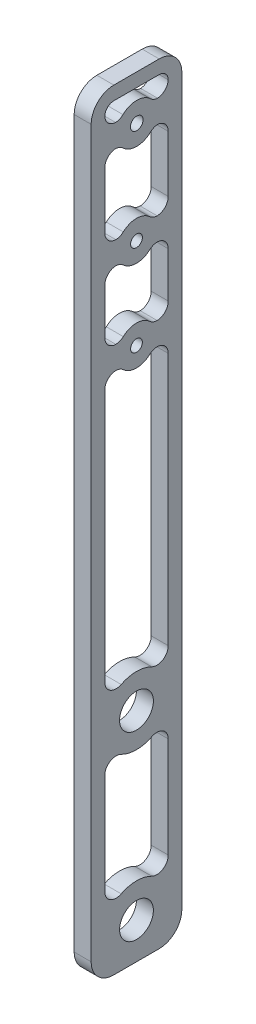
SolidWorks part; units mm, degrees
ref_plane "Front Plane" through (0, 0, 0) normal (0, 0, 1) x (1, 0, 0)
ref_plane "Top Plane" through (0, 0, 0) normal (0, 1, 0) x (1, 0, 0)
ref_plane "Right Plane" through (0, 0, 0) normal (1, 0, 0) x (0, 0, -1)
sketch "Sketch1" plane through (0, 0, 0) normal (1, 0, 0) x (0, 0, -1)
  line L5 (-12.7, -107.95) -> (12.7, -107.95)
  line L6 (-12.7, -107.95) -> (-12.7, 107.95)
  line L7 (-12.7, 107.95) -> (12.7, 107.95)
  line L8 (12.7, -107.95) -> (12.7, 107.95)
  line L9 (0, 107.95) -> (0, -107.95) construction
  line L10 (-12.7, 0) -> (12.7, 0) construction
  circle A0 centre (0, -97.79) radius 4.7371
  circle A1 centre (0, -46.99) radius 4.7371
  point P0 (0, 0)
  dimension "D3" = 50.8
  dimension "D4" = 9.4742
  dimension "D1" = 25.4
  dimension "D2" = 215.9
  dimension "D5" = 10.16
extrude "Boss-Extrude1" add sketch "Sketch1" along normal blind 4.7625
sketch "Sketch3" plane through (0, 0, 0) normal (-1, 0, 0) x (0, 0, 1)
  circle A0 centre (0, 41.5828) radius 1.651 construction
  circle A1 centre (0, 66.9828) radius 1.651 construction
  circle A2 centre (-0.0642, 95.4547) radius 1.778 construction
  circle A3 centre (0, 41.5828) radius 1.651
  circle A4 centre (0, 66.9828) radius 1.651
  circle A5 centre (-0.0642, 95.4547) radius 1.778
extrude "Cut-Extrude1" cut sketch "Sketch3" against normal through all
fillet "Fillet1" radius 6.35 4 edges at (2.3813, -107.95, 12.7) (2.3813, -107.95, -12.7) (2.3813, 107.95, -12.7) (2.3813, 107.95, 12.7)
sketch "Sketch4" plane through (4.7625, 0, 0) normal (1, 0, 0) x (0, 0, -1)
  line L16 (-12.7, 101.6) -> (-12.7, -101.6) construction
  line L17 (-6.35, -107.95) -> (6.35, -107.95) construction
  line L18 (12.7, -101.6) -> (12.7, 101.6) construction
  line L19 (6.35, 107.95) -> (-6.35, 107.95) construction
  line L20 (-12.7, 101.6) -> (-12.7, -101.6) construction
  line L21 (-6.35, -107.95) -> (6.35, -107.95) construction
  line L22 (12.7, -101.6) -> (12.7, 101.6) construction
  line L23 (6.35, 107.95) -> (-6.35, 107.95) construction
  line L24 (6.35, 104.14) -> (-6.35, 104.14)
  line L25 (-8.89, 101.6) -> (-8.89, 98.6297)
  line L26 (-6.35, -104.14) -> (-7.0654, -104.14) construction
  line L27 (8.89, -94.4418) -> (8.89, -50.3382)
  line L28 (-8.89, 98.6297) -> (-4.5342, 98.6297)
  line L29 (4.6626, 98.6297) -> (8.89, 98.6297)
  line L30 (8.89, 92.2797) -> (4.6626, 92.2797)
  line L31 (-4.5342, 92.2797) -> (-8.89, 92.2797)
  line L32 (-8.89, 98.6297) -> (-8.89, 92.2797) construction
  line L33 (-8.89, 92.2797) -> (-8.89, 70.1578)
  line L34 (-8.89, 101.6) -> (-8.89, -101.6) construction
  line L35 (8.89, 92.2797) -> (8.89, 98.6297) construction
  line L36 (8.89, 98.6297) -> (8.89, 101.6)
  line L37 (8.89, -101.6) -> (8.89, 101.6) construction
  line L38 (4.4432, 70.1578) -> (8.89, 70.1578)
  line L39 (8.89, 63.8078) -> (4.4432, 63.8078)
  line L40 (-8.89, 70.1578) -> (-4.4432, 70.1578)
  line L41 (-8.89, 63.8078) -> (-4.4432, 63.8078)
  line L42 (-8.89, 70.1578) -> (-8.89, 63.8078) construction
  line L43 (-8.89, 63.8078) -> (-8.89, 44.7578)
  line L44 (8.89, 63.8078) -> (8.89, 70.1578) construction
  line L45 (8.89, 70.1578) -> (8.89, 92.2797)
  line L46 (-8.89, -94.4418) -> (-8.89, -101.1382) construction
  line L47 (-8.89, -101.1382) -> (-8.89, -101.6) construction
  line L48 (-7.0654, -104.14) -> (7.0654, -104.14) construction
  line L49 (7.0654, -104.14) -> (6.35, -104.14) construction
  line L50 (-6.35, -104.14) -> (6.35, -104.14) construction
  line L51 (8.89, -101.6) -> (8.89, -101.1382) construction
  line L52 (8.89, -101.1382) -> (8.89, -94.4418) construction
  line L53 (8.89, 44.7578) -> (4.4432, 44.7578)
  line L54 (8.89, 38.4078) -> (4.4432, 38.4078)
  line L55 (-8.89, 44.7578) -> (-4.4432, 44.7578)
  line L56 (-8.89, 38.4078) -> (-4.4432, 38.4078)
  line L57 (8.89, 38.4078) -> (8.89, 44.7578) construction
  line L58 (8.89, 44.7578) -> (8.89, 63.8078)
  line L59 (-8.89, 44.7578) -> (-8.89, 38.4078) construction
  line L60 (-8.89, 38.4078) -> (-8.89, -43.6418)
  line L61 (8.89, -50.3382) -> (8.89, -43.6418) construction
  line L62 (8.89, -43.6418) -> (8.89, 38.4078)
  line L63 (-8.89, -43.6418) -> (-8.89, -50.3382) construction
  line L64 (-8.89, -50.3382) -> (-8.89, -94.4418)
  circle A0 centre (0, -97.79) radius 4.7371 construction
  circle A1 centre (0, -46.99) radius 4.7371 construction
  circle A2 centre (0, 41.5828) radius 1.651 construction
  circle A3 centre (0, 66.9828) radius 1.651 construction
  circle A4 centre (0.0642, 95.4547) radius 1.778 construction
  circle A5 centre (0, -97.79) radius 4.7371 construction
  circle A6 centre (0, -46.99) radius 4.7371 construction
  circle A7 centre (0, 41.5828) radius 1.651 construction
  circle A8 centre (0, 66.9828) radius 1.651 construction
  circle A9 centre (0.0642, 95.4547) radius 1.778 construction
  arc A10 (4.4432, 44.7578) -> (-4.4432, 44.7578) centre (0, 41.5828) ccw
  arc A11 (-4.4432, 63.8078) -> (4.4432, 63.8078) centre (0, 66.9828) ccw
  arc A12 (-4.5342, 92.2797) -> (-4.5342, 98.6297) centre (0.0642, 95.4547) ccw
  arc A13 (8.89, -94.4418) -> (-8.89, -94.4418) centre (0, -97.79) ccw
  arc A14 (8.89, -43.6418) -> (-8.89, -43.6418) centre (0, -46.99) ccw
  arc A15 (-6.35, 107.95) -> (-12.7, 101.6) centre (-6.35, 101.6) ccw construction
  arc A16 (-12.7, -101.6) -> (-6.35, -107.95) centre (-6.35, -101.6) ccw construction
  arc A17 (6.35, -107.95) -> (12.7, -101.6) centre (6.35, -101.6) ccw construction
  arc A18 (12.7, 101.6) -> (6.35, 107.95) centre (6.35, 101.6) ccw construction
  arc A19 (-6.35, 107.95) -> (-12.7, 101.6) centre (-6.35, 101.6) ccw construction
  arc A20 (-12.7, -101.6) -> (-6.35, -107.95) centre (-6.35, -101.6) ccw construction
  arc A21 (6.35, -107.95) -> (12.7, -101.6) centre (6.35, -101.6) ccw construction
  arc A22 (12.7, 101.6) -> (6.35, 107.95) centre (6.35, 101.6) ccw construction
  arc A23 (-6.35, 104.14) -> (-8.89, 101.6) centre (-6.35, 101.6) ccw
  arc A24 (-8.89, -101.6) -> (-6.35, -104.14) centre (-6.35, -101.6) ccw construction
  arc A25 (6.35, -104.14) -> (8.89, -101.6) centre (6.35, -101.6) ccw construction
  arc A26 (8.89, 101.6) -> (6.35, 104.14) centre (6.35, 101.6) ccw
  arc A27 (-4.5342, 98.6297) -> (-4.5342, 92.2797) centre (0.0642, 95.4547) ccw construction
  circle A28 centre (0.0642, 95.4547) radius 5.588 construction
  arc A29 (-4.4432, 70.1578) -> (-4.4432, 63.8078) centre (0, 66.9828) ccw construction
  circle A30 centre (0, 66.9828) radius 5.461 construction
  arc A31 (4.4432, 63.8078) -> (4.4432, 70.1578) centre (0, 66.9828) ccw construction
  arc A32 (4.4432, 70.1578) -> (-4.4432, 70.1578) centre (0, 66.9828) ccw
  arc A33 (8.89, -50.3382) -> (8.89, -43.6418) centre (0, -46.99) ccw construction
  circle A34 centre (0, -46.99) radius 9.4996 construction
  arc A35 (-8.89, -43.6418) -> (-8.89, -50.3382) centre (0, -46.99) ccw construction
  arc A36 (-8.89, -50.3382) -> (8.89, -50.3382) centre (0, -46.99) ccw
  arc A37 (8.89, -101.1382) -> (8.89, -94.4418) centre (0, -97.79) ccw construction
  circle A38 centre (0, -97.79) radius 9.4996 construction
  arc A39 (-8.89, -94.4418) -> (-8.89, -101.1382) centre (0, -97.79) ccw construction
  arc A40 (-8.89, -101.1382) -> (-7.0654, -104.14) centre (0, -97.79) ccw construction
  arc A41 (-7.0654, -104.14) -> (7.0654, -104.14) centre (0, -97.79) ccw construction
  arc A42 (7.0654, -104.14) -> (8.89, -101.1382) centre (0, -97.79) ccw construction
  arc A43 (4.4432, 38.4078) -> (4.4432, 44.7578) centre (0, 41.5828) ccw construction
  circle A44 centre (0, 41.5828) radius 5.461 construction
  arc A45 (-4.4432, 44.7578) -> (-4.4432, 38.4078) centre (0, 41.5828) ccw construction
  arc A46 (-4.4432, 38.4078) -> (4.4432, 38.4078) centre (0, 41.5828) ccw
  point P16 (-8.89, 41.5828)
  point P18 (-8.89, 66.9828)
  point P20 (-8.89, 95.4547)
  dimension "D1" = 3.81
  dimension "D4" = 6.35
  dimension "D2" = 4.7625
  dimension "D3" = 3.81
extrude "Cut-Extrude2" cut sketch "Sketch4" against normal through all contours A32 L38 L45 L30 A12 L31 L33 L40 | L36 A26 L24 A23 L25 L28 A12 L29 | A11 L41 L43 L55 A10 L53 L58 L39 | A46 L56 L60 A14 L62 L54 | A36 L64 A13 L27
fillet "Fillet2" radius 3.175 24 edges at (2.3813, 38.4078, 8.89) (2.3813, 38.4078, 4.4432) (2.3813, 38.4078, -4.4432) (2.3813, 38.4078, -8.89) (2.3813, 44.7578, -8.89) (2.3813, 44.7578, -4.4432) (2.3813, 44.7578, 4.4432) (2.3813, 44.7578, 8.89) (2.3813, 63.8078, 4.4432) (2.3813, 63.8078, -8.89) (2.3813, 63.8078, 8.89) (2.3813, 63.8078, -4.4432) (2.3813, 70.1578, -8.89) (2.3813, 70.1578, -4.4432) (2.3813, 70.1578, 4.4432) (2.3813, 70.1578, 8.89) (2.3813, 98.6297, 8.89) (2.3813, 92.2797, 8.89) (2.3813, 92.2797, 4.5342) (2.3813, 98.6297, 4.5342) (2.3813, 92.2797, -4.6626) (2.3813, 98.6297, -4.6626) (2.3813, 92.2797, -8.89) (2.3813, 98.6297, -8.89)
fillet "Fillet3" radius 3.175 6 edges at (2.3813, -94.4418, -8.89) (2.3813, -94.4418, 8.89) (2.3813, -50.3382, 8.89) (2.3813, -50.3382, -8.89) (2.3813, -43.6418, -8.89) (2.3813, -43.6418, 8.89)
